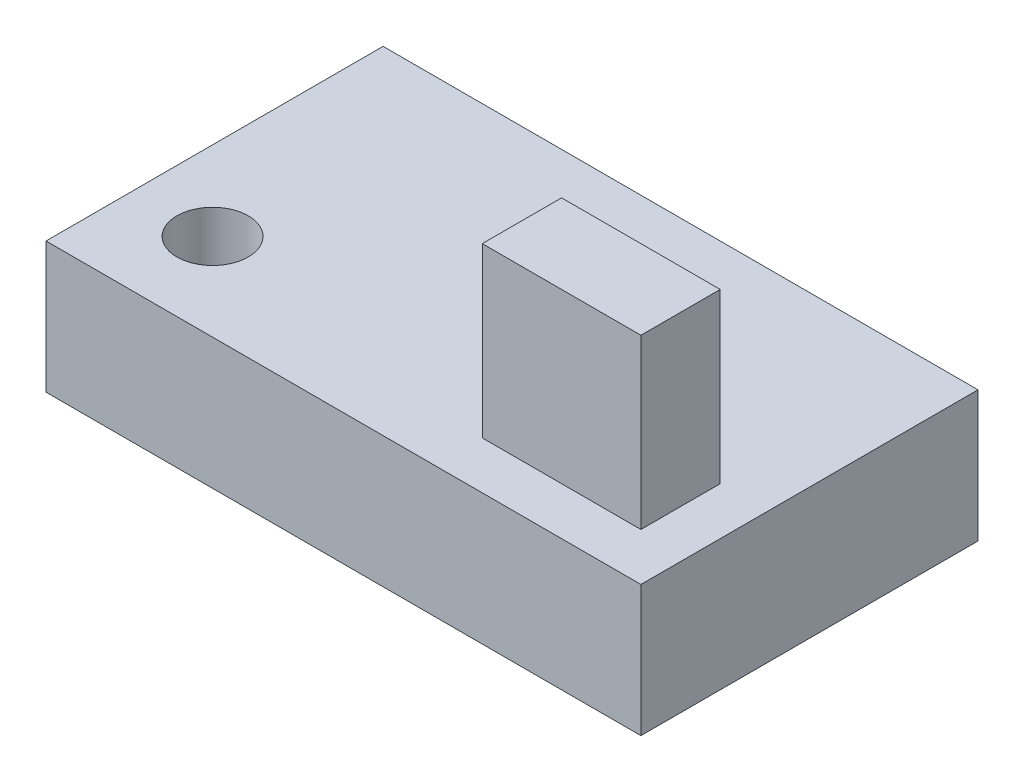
SolidWorks part; units mm, degrees
ref_plane "Front Plane" through (0, 0, 0) normal (0, 0, 1) x (1, 0, 0)
ref_plane "Top Plane" through (0, 0, 0) normal (0, 1, 0) x (1, 0, 0)
ref_plane "Right Plane" through (0, 0, 0) normal (1, 0, 0) x (0, 0, -1)
sketch "Sketch1" plane through (0, 0, 0) normal (0, -1, 0) x (1, 0, 0)
  line L0 (-75, 42.5) -> (75, -42.5) construction
  line L1 (-75, 42.5) -> (75, 42.5)
  line L2 (-75, 42.5) -> (-75, -42.5)
  line L3 (-75, -42.5) -> (75, -42.5)
  line L4 (75, 42.5) -> (75, -42.5)
  line L5 (-75, -42.5) -> (75, 42.5) construction
  point P4 (0, 0)
  dimension "D1" = 85
  dimension "D2" = 150
extrude "Boss-Extrude1" add sketch "Sketch1" along normal mid plane 33.02
sketch "Sketch2" plane through (0, 16.51, 0) normal (0, 1, 0) x (1, 0, 0)
  line L0 (75, 42.5) -> (75, -42.5) construction
  line L1 (63, -30.5) -> (23, -30.5)
  line L2 (63, -30.5) -> (63, -10.5)
  line L3 (63, -10.5) -> (23, -10.5)
  line L4 (23, -30.5) -> (23, -10.5)
  line L5 (75, -42.5) -> (-75, -42.5) construction
  dimension "D1" = 20
  dimension "D2" = 40
  dimension "D3" = 12
  dimension "D4" = 12
extrude "Boss-Extrude2" add sketch "Sketch2" along normal blind 42.418
sketch "Sketch3" plane through (0, 16.51, 0) normal (0, 1, 0) x (1, 0, 0)
  line L0 (23, -10.5) -> (23, -30.5) construction
  line L1 (-75, -42.5) -> (-75, 42.5) construction
  circle A0 centre (-55, -20.5) radius 9
  point P5 (23, -20.5)
  dimension "D2" = 18
  dimension "D1" = 20
extrude "Cut-Extrude1" cut sketch "Sketch3" against normal blind 15
